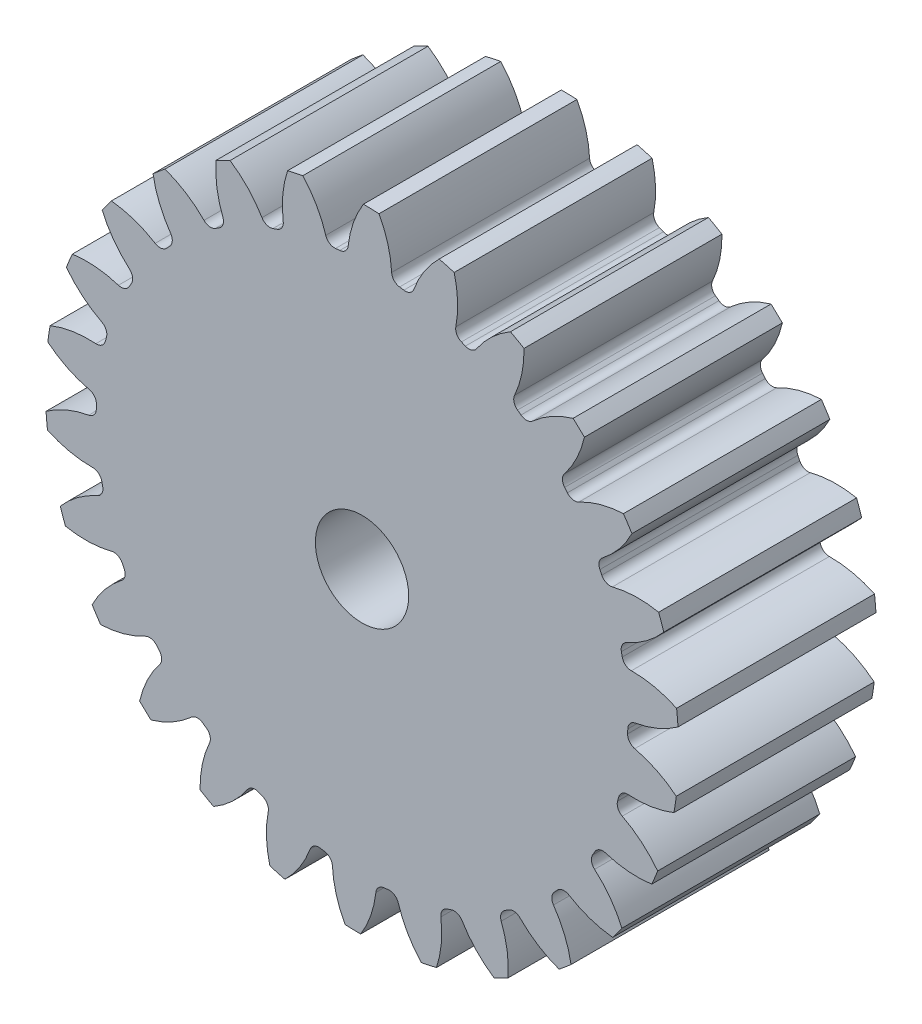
SolidWorks part; units mm, degrees
ref_plane "Front" through (0, 0, 0) normal (0, 0, 1) x (1, 0, 0)
ref_plane "Top" through (0, 0, 0) normal (0, 1, 0) x (1, 0, 0)
ref_plane "Right" through (0, 0, 0) normal (1, 0, 0) x (0, 0, -1)
sketch "Sketch3" plane through (0, 0, 0) normal (0, 0, 1) x (1, 0, 0)
  circle A0 centre (0, 0) radius 142.24
  dimension "od" = 284.48
extrude "gearBody" add sketch "Sketch3" along normal blind 88.9
sketch "Sketch2" plane through (0, 0, 0) normal (0, 0, 1) x (1, 0, 0)
  line L0 (0, 0) -> (114.6669, 47.4966) construction
  line L1 (141.4354, -18.0078) -> (0, 0) construction
  line L2 (0, 0) -> (36.3143, 0) construction
  line L3 (132.0153, 4.134) -> (131.5554, -11.7597) construction
  line L5 (131.7854, -3.8129) -> (0, 0) construction
  line L7 (0, 0) -> (124.1146, 0) construction
  arc A0 (124.1022, 1.7554) -> (123.7931, -8.9276) centre (0, 0) ccw construction
  arc A1 (141.9179, 9.5669) -> (141.1274, -17.7561) centre (0, 0) ccw construction
  arc A2 (132.0153, 4.134) -> (131.5554, -11.7597) centre (0, 0) ccw construction
  arc A3 (119.2982, -4.4194) -> (119.3541, -2.4854) centre (0, 0) ccw
  arc A4 (141.4354, -18.0078) -> (122.4787, -8.5965) centre (111.729, -54.0468) ccw
  arc A5 (141.4354, -18.0078) -> (142.24, 9.8004) centre (0, 0) ccw
  arc A6 (142.24, 9.8004) -> (122.7708, 1.5009) centre (114.6669, 47.4966) cw
  arc A7 (119.3541, -2.4854) -> (122.7708, 1.5009) centre (123.4883, -2.5715) cw
  arc A8 (122.4787, -8.5965) -> (119.2982, -4.4194) centre (123.4305, -4.5724) cw
  point P6 (142.24, 9.8004)
  point P22 (141.4354, -18.0078)
  dimension "baseDia" = 248.2292
  dimension "od" = 284.48
  dimension "pd" = 264.16
  dimension "rd" = 238.76
  dimension "rFillet" = 4.1351
  dimension "pointX" = 142.24
  dimension "pointY" = 9.8004
  dimension "CTT" = 15.8937
  dimension "flankCenterAngle" = 22.5
extrude "toothCut" cut sketch "Sketch2" along normal through all
pattern_circular "CirPattern1" count 26 over 360 about axis through (0, 0, 0) along (0, 0, 1) of "toothCut"
sketch "hub1Dia" plane through (0, 0, 0) normal (0, 0, -1) x (-1, 0, 0)
  circle A0 centre (0, 0) radius 12.7
  dimension "hub1Dia" = 25.4
sketch "hub2Dia" plane through (0, 0, 88.9) normal (0, 0, 1) x (1, 0, 0)
  circle A0 centre (0, 0) radius 12.7
  dimension "hub2dia" = 25.4
sketch "boreDia" plane through (0, 0, 0) normal (0, 0, 1) x (1, 0, 0)
  circle A0 centre (0, 0) radius 20.955
  dimension "boreDia" = 41.91
extrude "bore" cut sketch "boreDia" against normal mid plane 25400
